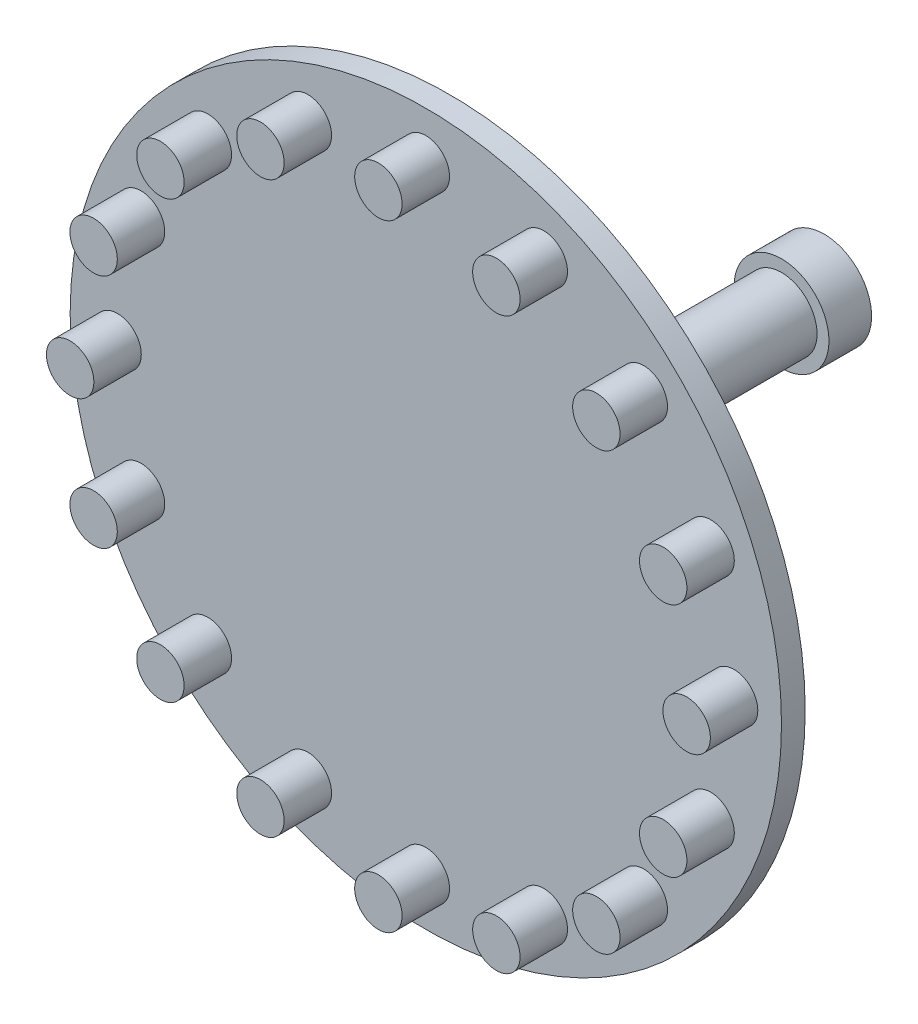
SolidWorks part; units mm, degrees
ref_plane "Front Plane" through (0, 0, 0) normal (0, 0, 1) x (1, 0, 0)
ref_plane "Top Plane" through (0, 0, 0) normal (0, 1, 0) x (1, 0, 0)
ref_plane "Right Plane" through (0, 0, 0) normal (1, 0, 0) x (0, 0, -1)
sketch "Sketch2" plane through (0, 0, 0) normal (0, 0, 1) x (1, 0, 0)
  circle A0 centre (0, 0) radius 7.5
  dimension "D1" = 15
extrude "Boss-Extrude1" add sketch "Sketch2" along normal blind 70
sketch "Sketch3" plane through (0, 0, 70) normal (0, 0, 1) x (1, 0, 0)
  circle A0 centre (0, 0) radius 75
  dimension "D1" = 150
extrude "Boss-Extrude2" add sketch "Sketch3" along normal blind 5
sketch "Sketch4" plane through (0, 0, 0) normal (0, 0, -1) x (-1, 0, 0)
  circle A0 centre (0, 0) radius 10
  dimension "D1" = 20
extrude "Boss-Extrude3" add sketch "Sketch4" along normal blind 9
sketch "Sketch5" plane through (0, 0, -9) normal (0, 0, -1) x (-1, 0, 0)
  circle A0 centre (0, 0) radius 2.5
  dimension "D1" = 5
extrude "Cut-Extrude1" cut sketch "Sketch5" against normal blind 5
sketch "Sketch6" plane through (0, 0, 75) normal (0, 0, 1) x (1, 0, 0)
  line L0 (-65, 0) -> (65, 0) construction
  line L1 (0, -65) -> (0, 65) construction
  line L2 (0, 0) -> (-45.9619, 45.9619) construction
  line L3 (0, 0) -> (45.9619, -45.9619) construction
  line L4 (0, 0) -> (45.9619, 45.9619) construction
  line L5 (0, 0) -> (-45.9619, -45.9619) construction
  line L6 (0, 0) -> (-24.8744, 60.0522) construction
  line L7 (-24.8744, -60.0522) -> (24.8744, 60.0522) construction
  line L8 (60.0522, 24.8744) -> (0, 0) construction
  line L9 (0, 0) -> (-60.0522, 24.8744) construction
  line L10 (0, 0) -> (60.0522, -24.8744) construction
  line L11 (0, 0) -> (-60.0522, -24.8744) construction
  line L12 (0, 0) -> (24.8744, -60.0522) construction
  circle A0 centre (0, 0) radius 65
  circle A1 centre (-24.8744, -60.0522) radius 5
  circle A2 centre (-45.9619, -45.9619) radius 5
  circle A3 centre (-60.0522, -24.8744) radius 5
  circle A4 centre (-65, 0) radius 5
  circle A5 centre (-45.9619, 45.9619) radius 5
  circle A6 centre (-60.0522, 24.8744) radius 5
  circle A7 centre (-24.8744, 60.0522) radius 5
  circle A8 centre (0, 65) radius 5
  circle A9 centre (24.8744, 60.0522) radius 5
  circle A10 centre (45.9619, 45.9619) radius 5
  circle A11 centre (60.0522, 24.8744) radius 5
  circle A12 centre (65, 0) radius 5
  circle A13 centre (60.0522, -24.8744) radius 5
  circle A14 centre (45.9619, -45.9619) radius 5
  circle A15 centre (24.8744, -60.0522) radius 5
  circle A16 centre (0, -65) radius 5
  dimension "D1" = 130
  dimension "D13" = 10
  dimension "D14" = 10
  dimension "D15" = 10
  dimension "D16" = 10
  dimension "D17" = 10
  dimension "D18" = 10
  dimension "D19" = 10
  dimension "D20" = 10
  dimension "D21" = 10
  dimension "D22" = 10
  dimension "D23" = 10
  dimension "D24" = 10
  dimension "D25" = 10
  dimension "D26" = 10
  dimension "D27" = 10
  dimension "D28" = 10
  dimension "D2" = 45
  dimension "D3" = 45
  dimension "D4" = 45
  dimension "D5" = 45
  dimension "D6" = 22.5
  dimension "D7" = 22.5
  dimension "D8" = 22.5
  dimension "D9" = 22.5
  dimension "D10" = 22.5
  dimension "D11" = 22.5
  dimension "D12" = 22.5
extrude "Boss-Extrude4" add sketch "Sketch6" along normal blind 10 contours A0 A1 | A0 A1 | A0 A16 | A0 A16 | A0 A15 | A0 A15 | A0 A14 | A0 A13 | A0 A13 | A0 A12 | A0 A12 | A0 A11 | A0 A11 | A0 A10 | A0 A10 | A0 A9 | A0 A9 | A0 A8 | A0 A8 | A0 A7 | A0 A7 | A0 A5 | A0 A5 | A0 A6 | A0 A4 | A0 A4 | A0 A3 | A0 A3 | A0 A2 | A0 A2
